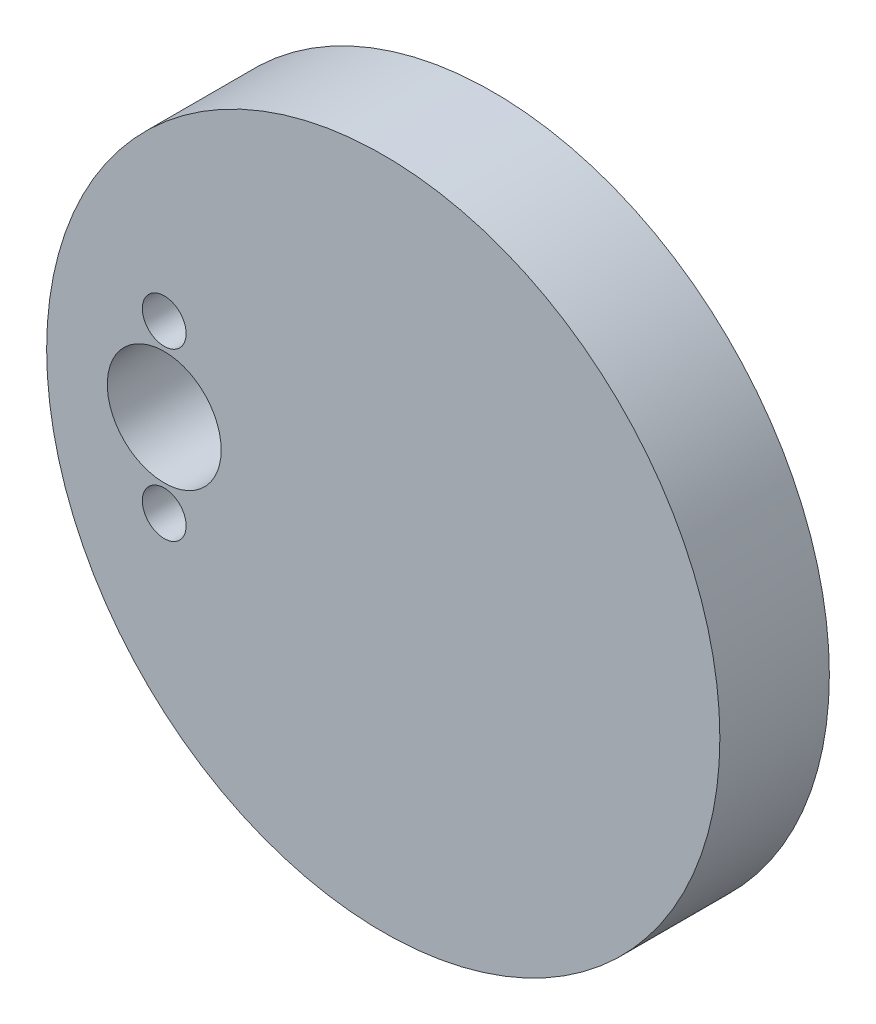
SolidWorks part; units mm, degrees
ref_plane "Front Plane" through (0, 0, 0) normal (0, 0, 1) x (1, 0, 0)
ref_plane "Top Plane" through (0, 0, 0) normal (0, 1, 0) x (1, 0, 0)
ref_plane "Right Plane" through (0, 0, 0) normal (1, 0, 0) x (0, 0, -1)
sketch "Sketch1" plane through (0, 0, 0) normal (0, 0, 1) x (1, 0, 0)
  line L0 (0, 0) -> (-25.4, 0) construction
  line L1 (-25.4, 9.652) -> (-25.4, 0) construction
  line L2 (-25.4, 0) -> (-25.4, -9.652) construction
  circle A0 centre (0, 0) radius 39.0398
  circle A1 centre (-25.4, 0) radius 6.604
  circle A2 centre (-25.4, 9.652) radius 2.54
  circle A3 centre (-25.4, -9.652) radius 2.54
  dimension "D1" = 78.0796
  dimension "D2" = 13.208
  dimension "D3" = 5.08
  dimension "D4" = 9.652
  dimension "D5" = 25.4
extrude "Boss-Extrude1" add sketch "Sketch1" along normal mid plane 12.7
